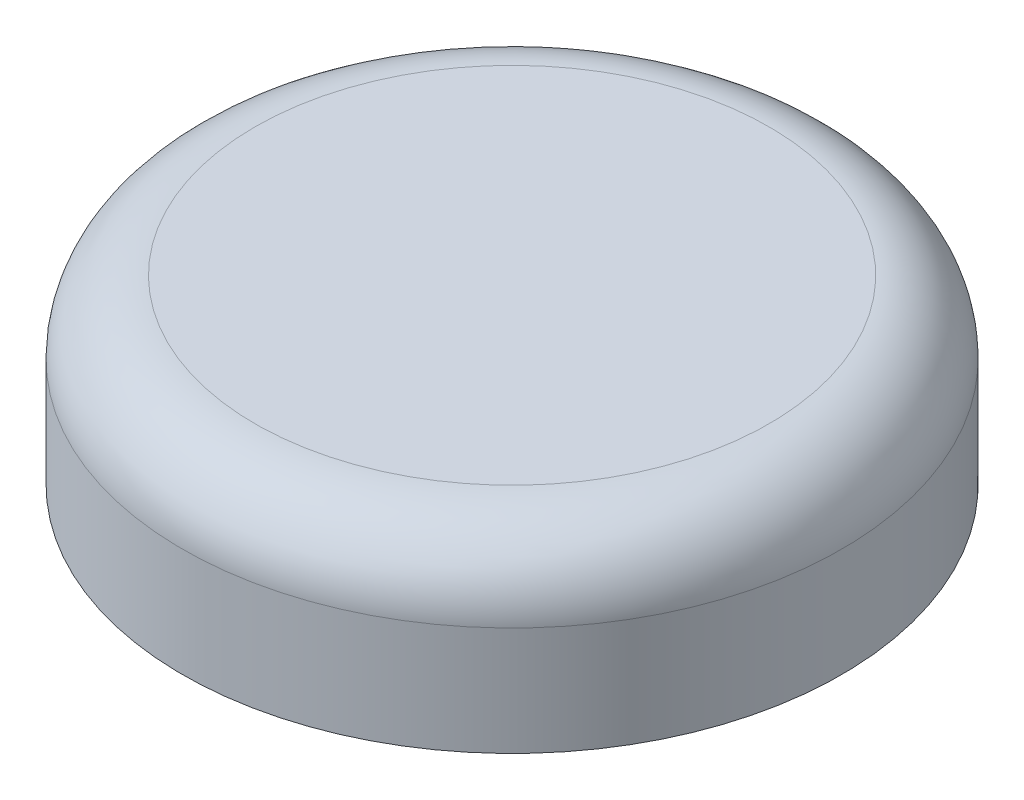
SolidWorks part; units mm, degrees
ref_plane "Plan de face" through (0, 0, 0) normal (0, 0, 1) x (1, 0, 0)
ref_plane "Plan de dessus" through (0, 0, 0) normal (0, 1, 0) x (1, 0, 0)
ref_plane "Plan de droite" through (0, 0, 0) normal (1, 0, 0) x (0, 0, -1)
sketch "Esquisse1" plane through (0, 0, 0) normal (0, 0, 1) x (1, 0, 0)
  line L0 (-2, 3) -> (-7.1, 3)
  line L1 (-7.1, 3) -> (-7.1, 1)
  line L2 (-8.1, 0) -> (-9.1, 0)
  line L3 (-9.1, 0) -> (-9.1, 3)
  line L4 (-7.1, 5) -> (0, 5)
  line L5 (0, 5) -> (0, 3)
  line L6 (-7.1, 1) -> (-8.1, 0)
  line L7 (-2, 3) -> (-2, -1)
  line L8 (-1, -2) -> (0, -2)
  line L9 (0, -2) -> (0, 3)
  line L10 (-2, -1) -> (-1, -2)
  arc A1 (-7.1, 5) -> (-9.1, 3) centre (-7.1, 3) ccw
  point P1 (-6.7311, 6)
  point P3 (-7.1, 0)
  point P9 (-7.1, 5.7545)
  point P11 (-7.1, 3)
  point P14 (-9.1, 5)
  point P16 (-2, -2)
  dimension "D5" = 5
  dimension "D1" = 9.1
  dimension "D2" = 2
  dimension "D3" = 2
  dimension "D4" = 3
revolve "Révolution1" add sketch "Esquisse1" angle 360 about L5
